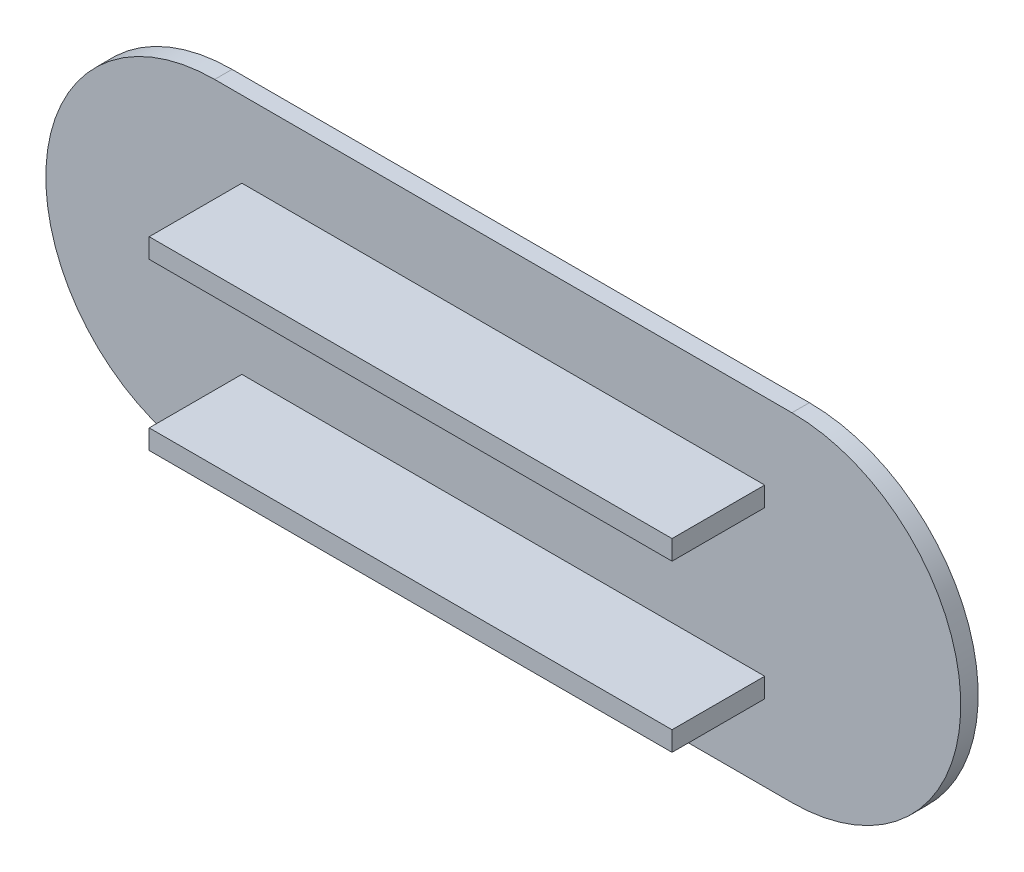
SolidWorks part; units mm, degrees
other "Solid1"
ref_plane "Front Plane" through (0, 0, 0) normal (0, 0, 1) x (1, 0, 0)
ref_plane "Top Plane" through (0, 0, 0) normal (0, 1, 0) x (1, 0, 0)
ref_plane "Right Plane" through (0, 0, 0) normal (1, 0, 0) x (0, 0, -1)
imported_body "Imported1"
sketch "Sketch1" plane through (0, 0, 0) normal (0, 0, -1) x (-1, 0, 0)
  line L0 (-20.8132, -1.6914) -> (20.8132, -1.6914) construction
  arc A0 (-13.25, 7.75) -> (-13.25, -7.75) centre (-13.25, 0) ccw construction
  arc A1 (13.25, -7.75) -> (13.25, 7.75) centre (13.25, 0) ccw construction
  text T0 "GreenLab" font "Copperplate Gothic Bold" height 3.5
extrude "Cut-Extrude1" cut sketch "Sketch1" against normal blind 0.5
